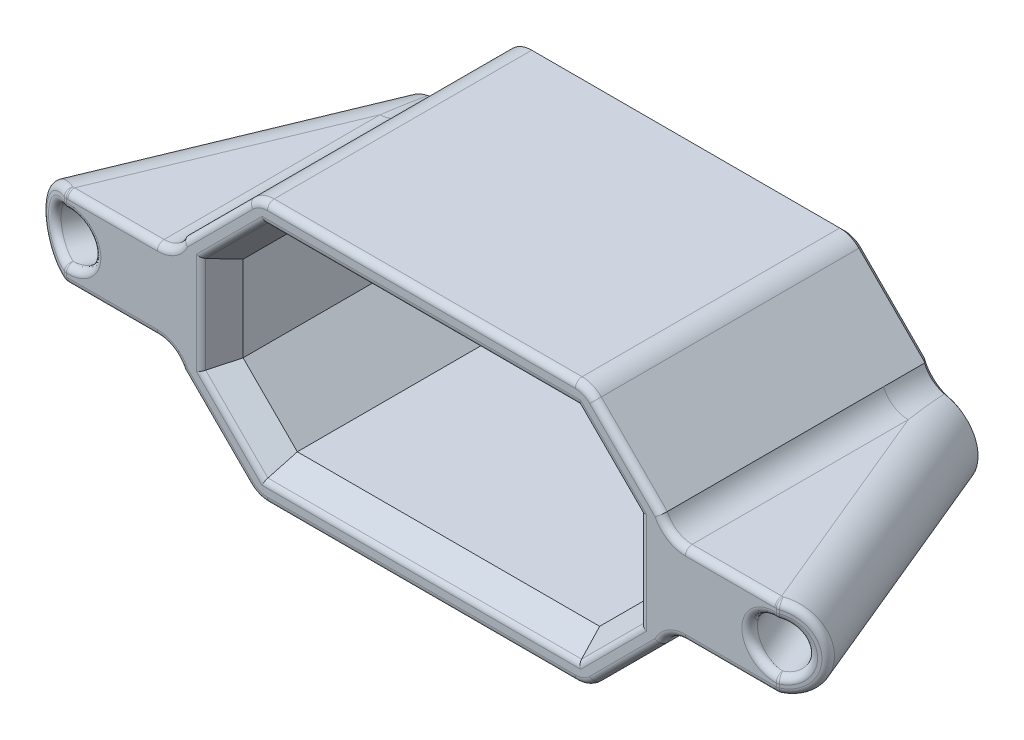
SolidWorks part; units mm, degrees
ref_plane "Front Plane" through (0, 0, 0) normal (0, 0, 1) x (1, 0, 0)
ref_plane "Top Plane" through (0, 0, 0) normal (0, 1, 0) x (1, 0, 0)
ref_plane "Right Plane" through (0, 0, 0) normal (1, 0, 0) x (0, 0, -1)
sketch "Sketch1" plane through (0, 0, 0) normal (0, 0, 1) x (1, 0, 0)
  line L0 (-15.15, 3.15) -> (-11.15, 7.15)
  line L1 (-11.15, -7.15) -> (11.15, -7.15)
  line L2 (-15.15, -3.15) -> (-15.15, 3.15)
  line L3 (-11.15, 7.15) -> (11.15, 7.15)
  line L4 (15.15, -3.15) -> (15.15, 3.15)
  line L5 (-15.15, -7.15) -> (15.15, 7.15) construction
  line L6 (-15.15, 7.15) -> (15.15, -7.15) construction
  line L7 (11.15, 7.15) -> (15.15, 3.15)
  line L8 (11.15, -7.15) -> (15.15, -3.15)
  line L9 (-15.15, -3.15) -> (-11.15, -7.15)
  point P0 (0, 0)
  dimension "D1" = 30.3
  dimension "D2" = 14.3
extrude "Extrude-Thin1" add sketch "Sketch1" along normal blind 20 thin
sketch "Sketch2" plane through (0, 0, 0) normal (0, 1, 0) x (1, 0, 0)
  line L0 (-18, 0) -> (-26.2843, -20) construction
  line L1 (-7.8439, -20) -> (-26.2843, -20) construction
  line L2 (12.1855, -20) -> (-12.1855, -20) construction
  line L3 (-18, 0) -> (0, 0) construction
  line L4 (0, 0) -> (0, -26.9606) construction
  line L5 (-26.2843, -20) -> (-36.6504, -15.7062)
  dimension "D1" = 22.5
  dimension "D2" = 18
ref_plane "Plane1" through (-10.9203, 0, 26.364) normal (-0.3827, 0, 0.9239) x (0.9239, 0, 0.3827)
sketch "Sketch3" plane through (-10.9203, 0, 26.364) normal (-0.3827, 0, 0.9239) x (0.9239, 0, 0.3827)
  line L0 (-16.6298, 0) -> (-8.6298, 0) construction
  line L1 (-16.6298, 3) -> (-8.6298, 3)
  line L2 (-16.6298, -3) -> (-8.6298, -3)
  line L3 (-8.6298, 3) -> (-8.6298, -3)
  arc A0 (-16.6298, 3) -> (-16.6298, -3) centre (-16.6298, 0) ccw
  arc A1 (-8.6298, -3) -> (-8.6298, 3) centre (-8.6298, 0) ccw construction
  circle A2 centre (-16.6298, 0) radius 1.75
  point P4 (-12.6298, 0)
  dimension "D1" = 3.5
  dimension "D2" = 3
  dimension "D3" = 8
extrude "Boss-Extrude1" add sketch "Sketch3" against normal up to surface (3.2487 mm away) separate body
sketch "Sketch4" plane through (0, 0, 0) normal (0, 1, 0) x (1, 0, 0)
  line L0 (4.454, -20) -> (-40.546, -20)
  line L1 (-40.546, -20) -> (-40.546, 0)
  line L2 (-40.546, 0) -> (0, 0)
  line L3 (12.1855, -20) -> (-12.1855, -20) construction
  dimension "D1" = 45
extrude "Cut-Extrude1" cut sketch "Sketch4" against normal through all both and the other way through all
mirror "Mirror3" about plane through (0, 0, 0) normal (1, 0, 0)
combine bodies "Combine1" operation type add bodies to combine 105 101 103
fillet "Fillet2" radius 2 4 edges at (-17.65, -3, 10) (-17.65, 3, 10) (17.65, -3, 10) (17.65, 3, 10)
chamfer "Chamfer2" distance 2 angle 30 8 edges at (-13.15, -5.15, 20) (-15.15, 0, 20) (-13.15, 5.15, 20) (0, 7.15, 20) (13.15, 5.15, 20) (15.15, 0, 20) (13.15, -5.15, 20) (0, -7.15, 20)
chamfer "Chamfer3" distance 2 angle 30 8 edges at (-13.15, 5.15, 0) (0, 7.15, 0) (13.15, 5.15, 0) (15.15, 0, 0) (13.15, -5.15, 0) (0, -7.15, 0) (-13.15, -5.15, 0) (-15.15, 0, 0)
fillet "Fillet3" radius 2 4 edges at (12.1855, -9.65, 10) (-12.1855, -9.65, 10) (-12.1855, 9.65, 10) (12.1855, 9.65, 10)
chamfer "Chamfer4" distance 0.5 angle 45 30 edges at (-19.8942, 0, 0) (-17.65, 0, 3.728) (-17.65, 0, 0) (17.65, 0, 3.728) (17.65, 0, 0) (19.8942, 0, 0) (18.3922, -3.1546, 0) (21.2472, 0, 0) (17.962, 3.5785, 0) (15.2107, 6.6249, 0) (12.1225, 9.4978, 0) (0, 9.65, 0) (-12.1225, 9.4978, 0) (-15.2107, 6.6249, 0) (-18.3922, 3.1546, 0) (-21.2472, 0, 0) (-17.962, -3.5785, 0) (-15.2107, -6.6249, 0) (-12.1225, -9.4978, 0) (0, -9.65, 0) (12.1225, -9.4978, 0) (15.2107, -6.6249, 0) (13.9665, 5.9665, 0) (16.3047, 0, 0) (13.9665, -5.9665, 0) (0, -8.3047, 0) (-13.9665, -5.9665, 0) (-16.3047, 0, 0) (-13.9665, 5.9665, 0) (0, 8.3047, 0)
fillet "Fillet4" radius 0.5 32 edges at (-12.1225, -9.4978, 20) (-15.2107, -6.6249, 20) (-18.3878, -3.3224, 20) (-22.8805, -3, 20) (-26.2843, -2.375, 20) (-26.2843, 2.375, 20) (-24.3901, 0, 20) (-22.8805, 3, 20) (-18.3878, 3.3224, 20) (-15.2107, 6.6249, 20) (-12.1225, 9.4978, 20) (0, 9.65, 20) (12.1225, 9.4978, 20) (15.2107, 6.6249, 20) (18.3878, 3.3224, 20) (22.8805, 3, 20) (26.2843, 2.375, 20) (24.3901, 0, 20) (26.2843, -2.375, 20) (22.8805, -3, 20) (18.3878, -3.3224, 20) (15.2107, -6.6249, 20) (12.1225, -9.4978, 20) (0, -9.65, 20) (13.9665, -5.9665, 20) (16.3047, 0, 20) (13.9665, 5.9665, 20) (0, 8.3047, 20) (-13.9665, 5.9665, 20) (-16.3047, 0, 20) (-13.9665, -5.9665, 20) (0, -8.3047, 20)
fillet "Fillet5" radius 0.5 12 edges at (29.0559, 0, 18.8519) (27.9011, 0, 19.3303) (-29.0559, 0, 18.8519) (-27.9011, 0, 19.3303)
